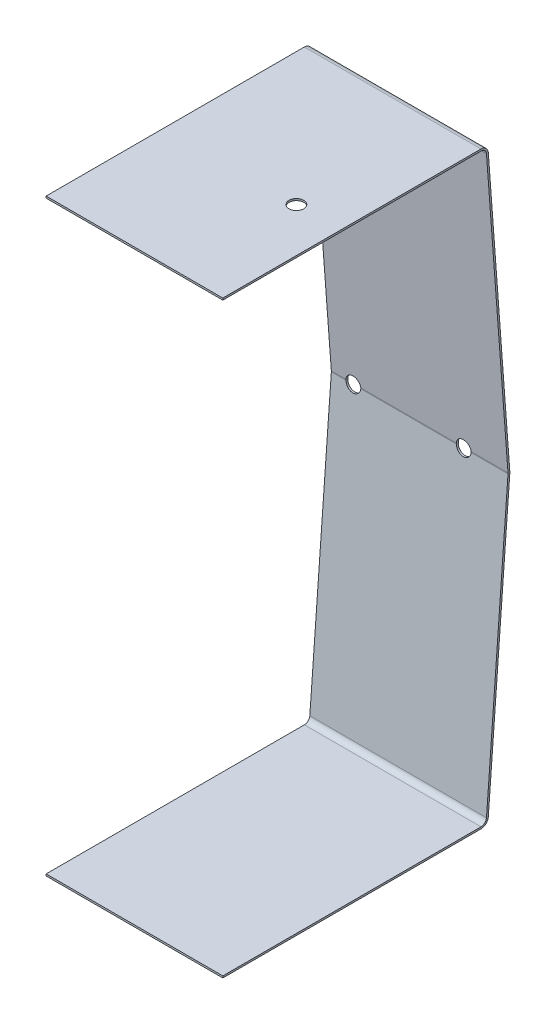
SolidWorks part; units mm, degrees
ref_plane "Front Plane" through (0, 0, 0) normal (0, 0, 1) x (1, 0, 0)
ref_plane "Top Plane" through (0, 0, 0) normal (0, 1, 0) x (1, 0, 0)
ref_plane "Right Plane" through (0, 0, 0) normal (1, 0, 0) x (0, 0, -1)
sketch "Sketch1" plane through (0, 0, 0) normal (0, 0, 1) x (1, 0, 0)
  line L0 (-76.2, 254) -> (-76.2, -254) construction
  line L1 (-76.2, 254) -> (76.2, 254)
  line L2 (-76.2, 254) -> (-76.2, -254)
  line L3 (-76.2, -254) -> (76.2, -254)
  line L4 (76.2, 254) -> (76.2, -254)
  line L5 (76.2, 254) -> (76.2, -254) construction
  line L6 (-76.2, 254) -> (76.2, -254) construction
  dimension "D1" = 508
extrude "Extrude1" add sketch "Sketch1" against normal offset from surface (228.6 mm away) 101.6
sketch "Sketch2" plane through (76.2, 0, 0) normal (1, 0, 0) x (0, 0, -1)
  line L0 (228.6, 254) -> (247.65, 0)
  line L1 (247.65, 0) -> (228.6, -254)
  line L2 (228.6, -254) -> (228.6, 254)
  line L3 (247.65, 0) -> (0, 0) construction
  dimension "D1" = 19.05
extrude "Extrude2" add sketch "Sketch2" against normal up to surface (152.4 mm away)
fillet "Fillet1" radius 6.35 3 edges at (0, 254, -228.6) (0, 0, -247.65) (0, -254, -228.6)
shell "Shell1" thickness 1.5875
sketch "Sketch3" plane through (0, 0, 0) normal (0, 0, 1) x (1, 0, 0)
  line L0 (-76.2, 0.3562) -> (-76.2, 248.0062) construction
  line L1 (76.2, 0.3562) -> (76.2, 248.0062) construction
  circle A0 centre (-57.15, 0) radius 6.35
  circle A1 centre (38.1, 0) radius 6.35
  dimension "D3" = 12.7
  dimension "D1" = 19.05
  dimension "D2" = 38.1
extrude "Cut-Extrude1" cut sketch "Sketch3" against normal through all
sketch "Sketch4" plane through (0, 254, 0) normal (0, 1, 0) x (1, 0, 0)
  line L0 (76.2, 222.7084) -> (76.2, 0) construction
  line L1 (76.2, 0) -> (-76.2, 0) construction
  circle A0 centre (38.1, 101.6) radius 6.35
  dimension "D1" = 12.7
  dimension "D2" = 38.1
  dimension "D3" = 101.6
extrude "Cut-Extrude2" cut sketch "Sketch4" against normal up to next
